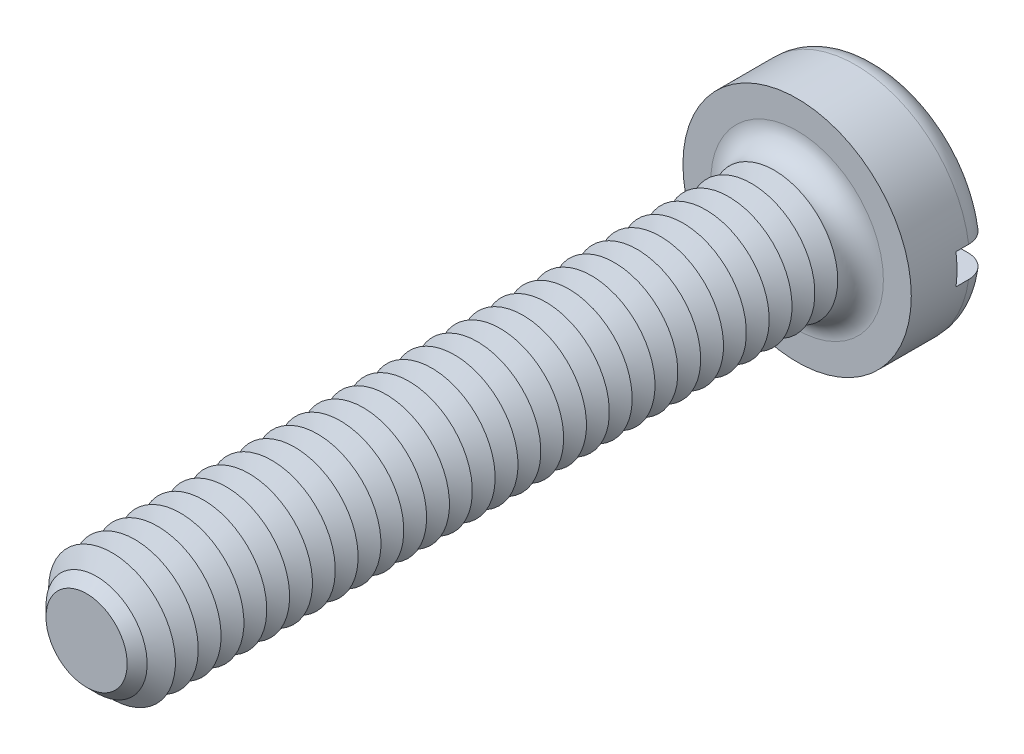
SolidWorks part; units mm, degrees
ref_plane "Front Plane" through (0, 0, 0) normal (0, 0, 1) x (1, 0, 0)
ref_plane "Top Plane" through (0, 0, 0) normal (0, 1, 0) x (1, 0, 0)
ref_plane "Right Plane" through (0, 0, 0) normal (1, 0, 0) x (0, 0, -1)
sketch "Sketch3" plane through (0, 0, 0) normal (0, 0, 1) x (1, 0, 0)
  circle A0 centre (0, 0) radius 2.25
  dimension "D1" = 4.5
extrude "Boss-Extrude2" add sketch "Sketch3" against normal blind 1.6
sketch "Sketch4" plane through (0, 0, 0) normal (0, 0, 1) x (1, 0, 0)
  circle A0 centre (0, 0) radius 1.25
  dimension "D1" = 2.5
extrude "Boss-Extrude3" add sketch "Sketch4" along normal blind 14
fillet "Fillet1" radius 0.45 2 edges at (2.25, 0, -1.6) (1.25, 0, 0)
chamfer "Chamfer1" distance 0.45 angle 45 1 edges at (1.25, 0, 14)
sketch "Sketch5" plane through (0, 0, 0) normal (1, 0, 0) x (0, 0, -1)
  line L0 (1.6944, 0) -> (-7.6738, 0) construction
sketch "Sketch6" plane through (0, 0, 0) normal (1, 0, 0) x (0, 0, -1)
  line L0 (-0.45, 1.25) -> (-0.675, 0.8603)
  line L1 (-0.675, 0.8603) -> (-0.9, 1.25)
  line L2 (-0.45, 1.25) -> (-13.55, 1.25) construction
  line L3 (-0.9, 1.25) -> (-0.45, 1.25)
  dimension "D1" = 0.45
revolve "Cut-Revolve1" cut sketch "Sketch6" angle 360 about L0
pattern_linear "LPattern1" count 30 spacing 0.45 along (0, 0, 1) of "Cut-Revolve1"
sketch "Sketch8" plane through (0, 0, -1.6) normal (0, 0, -1) x (-1, 0, 0)
  line L1 (2.25, -0.3) -> (-2.25, -0.3)
  line L2 (2.25, -0.3) -> (2.25, 0.3)
  line L3 (2.25, 0.3) -> (-2.25, 0.3)
  line L4 (-2.25, -0.3) -> (-2.25, 0.3)
  line L5 (2.25, -0.3) -> (-2.25, 0.3) construction
  line L6 (2.25, 0.3) -> (-2.25, -0.3) construction
  point P0 (0, 0)
  dimension "D1" = 4.5
  dimension "D2" = 0.6
extrude "Cut-Extrude1" cut sketch "Sketch8" against normal blind 0.7
